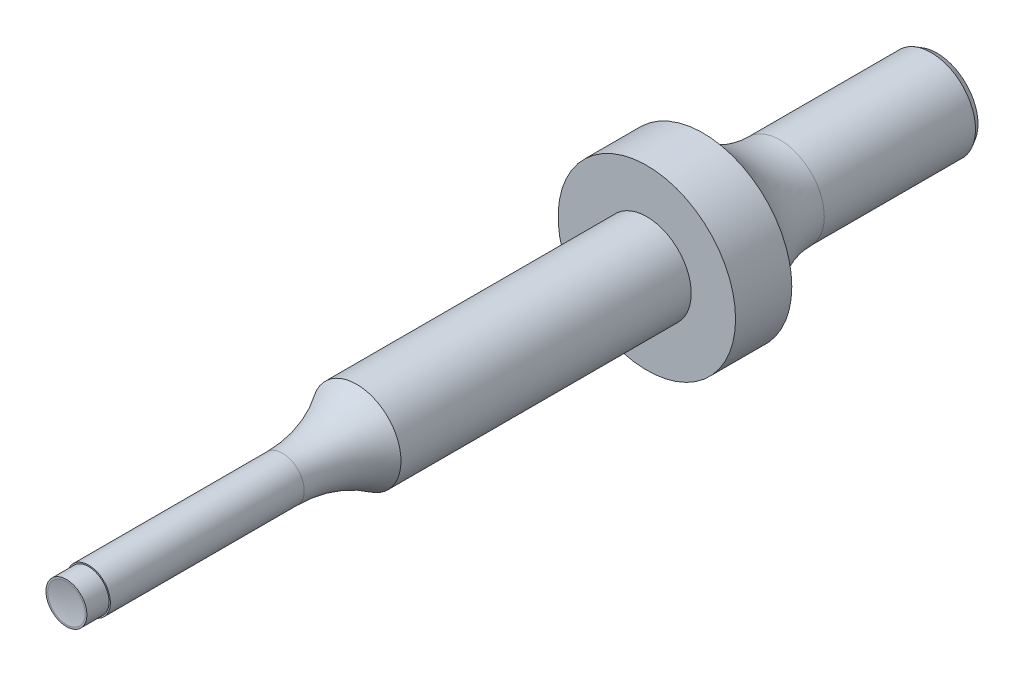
SolidWorks part; units mm, degrees
ref_plane "Front Plane" through (0, 0, 0) normal (0, 0, 1) x (1, 0, 0)
ref_plane "Top Plane" through (0, 0, 0) normal (0, 1, 0) x (1, 0, 0)
ref_plane "Right Plane" through (0, 0, 0) normal (1, 0, 0) x (0, 0, -1)
sketch "Sketch1" plane through (0, 0, 0) normal (0, 0, 1) x (1, 0, 0)
  circle A0 centre (0, 0) radius 5.095
  dimension "D1" = 10.19
extrude "Boss-Extrude1" add sketch "Sketch1" against normal blind 100
sketch "Sketch2" plane through (0, 0, 0) normal (0, 0, 1) x (1, 0, 0)
  circle A0 centre (0, 0) radius 2.5
  dimension "D1" = 5
extrude "Cut-Extrude1" cut sketch "Sketch2" against normal blind 33.3333 flip side to cut
sketch "Sketch3" plane through (0, 0, 0) normal (0, 0, 1) x (1, 0, 0)
  circle A0 centre (0, 0) radius 2.35
  dimension "D1" = 4.7
extrude "Cut-Extrude2" cut sketch "Sketch3" against normal blind 2.5475 flip side to cut
sketch "Sketch4" plane through (0, 0, 0) normal (1, 0, 0) x (0, 0, -1)
  line L0 (0, 0) -> (0, 2.15)
  line L1 (0, 2.35) -> (0, -2.35) construction
  line L2 (0.2294, 0) -> (0.2294, 2.15) construction
  line L3 (0, 0) -> (0.2294, 0)
  line L4 (0, 0) -> (0, -2.15) construction
  arc A0 (0.2294, 0) -> (0, 2.15) centre (-9.9606, 0) ccw
  dimension "D2" = 10.19
  dimension "D1" = 4.3
revolve "Cut-Revolve1" cut sketch "Sketch4" angle 360 about L3
chamfer "Chamfer1" distance 0.6793 angle 30 1 edges at (5.095, 0, -100)
sketch "Sketch5" plane through (0, 0, 0) normal (1, 0, 0) x (0, 0, -1)
  line L0 (33.3333, 0) -> (24.8131, 0)
  line L1 (33.3333, 5.095) -> (33.3333, -5.095) construction
  line L2 (24.8131, 0) -> (24.8131, 2.5)
  line L3 (33.3333, 2.5) -> (2.5475, 2.5) construction
  line L4 (33.3333, 5.095) -> (33.3333, 0)
  line L5 (24.8131, 2.5) -> (33.3333, 2.5) construction
  arc A0 (24.8131, 2.5) -> (33.3333, 5.095) centre (24.8131, 17.785) ccw
  dimension "D1" = 15.285
revolve "Revolve1" add sketch "Sketch5" angle 360 about L0
sketch "Sketch6" plane through (0, 0, 0) normal (1, 0, 0) x (0, 0, -1)
  line L0 (66.6667, 0) -> (81.9517, 0)
  line L1 (66.6667, 0) -> (66.6667, 10.19)
  line L2 (66.6667, 10.19) -> (73.1269, 10.19)
  line L3 (81.9517, 0) -> (81.9517, 5.095)
  line L4 (99.3207, 5.095) -> (33.3333, 5.095) construction
  line L5 (81.9517, 5.095) -> (66.6667, 5.095) construction
  line L6 (100, -5.095) -> (100, 5.095) construction
  arc A0 (81.9517, 5.095) -> (73.1269, 10.19) centre (81.9517, 15.285) cw
  dimension "D2" = 10.19
  dimension "D1" = 33.3333
  dimension "D3" = 15.285
revolve "Revolve2" add sketch "Sketch6" angle 360 about L0
sketch "Sketch7" plane through (0, 0, -100) normal (0, 0, -1) x (-1, 0, 0)
  line L9 (-8.6234, 1.9603) -> (-4.7028, 1.9603)
  line L10 (-8.6234, 1.9603) -> (-8.6234, -1.9603)
  line L11 (-8.6234, -1.9603) -> (-4.7028, -1.9603)
  line L12 (-4.7028, 1.9603) -> (-4.7028, -1.9603)
  circle A5 centre (0, 0) radius 5.095 construction
  circle A6 centre (0, 0) radius 4.7028 construction
  point P8 (-4.7028, 0)
extrude "Cut-Extrude3" [suppressed] cut sketch "Sketch7" against normal through all
